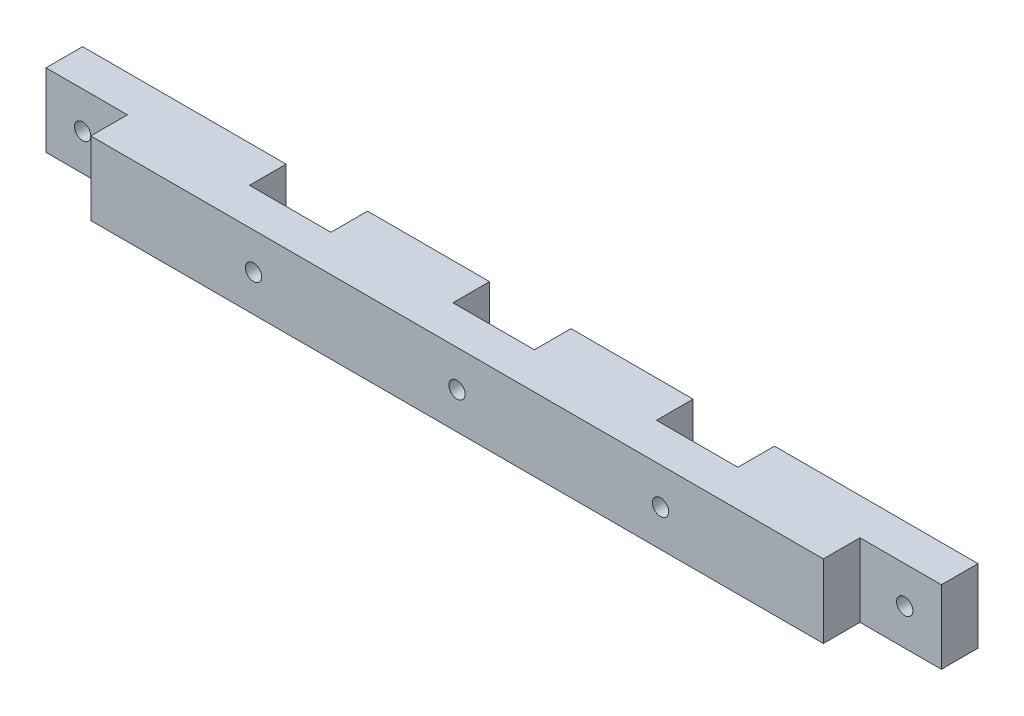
SolidWorks part; units mm, degrees
ref_plane "Face" through (0, 0, 0) normal (0, 0, 1) x (1, 0, 0)
ref_plane "Dessus" through (0, 0, 0) normal (0, 1, 0) x (1, 0, 0)
ref_plane "Droite" through (0, 0, 0) normal (1, 0, 0) x (0, 0, -1)
sketch "Esquisse1" plane through (0, 0, 0) normal (0, 0, 1) x (1, 0, 0)
  line L1 (-67.2717, -109.6176) -> (42.7283, -109.6176)
  line L2 (-67.2717, -109.6176) -> (-67.2717, -100.6176)
  line L3 (-67.2717, -100.6176) -> (42.7283, -100.6176)
  line L4 (42.7283, -109.6176) -> (42.7283, -100.6176)
  dimension "D1" = 110
  dimension "D2" = 9
extrude "Extrusion1" add sketch "Esquisse1" along normal blind 9
sketch "Esquisse2" plane through (0, 0, 9) normal (0, 0, 1) x (1, 0, 0)
  line L0 (42.7283, -100.6176) -> (-67.2717, -100.6176) construction
  line L1 (-67.2717, -109.6176) -> (-57.2717, -109.6176)
  line L2 (-67.2717, -109.6176) -> (-67.2717, -100.6176)
  line L3 (-67.2717, -100.6176) -> (-57.2717, -100.6176)
  line L4 (-57.2717, -109.6176) -> (-57.2717, -100.6176)
  line L6 (42.7283, -109.6176) -> (32.7283, -109.6176)
  line L7 (42.7283, -109.6176) -> (42.7283, -100.6176)
  line L8 (42.7283, -100.6176) -> (32.7283, -100.6176)
  line L9 (32.7283, -109.6176) -> (32.7283, -100.6176)
  dimension "D1" = 10
  dimension "D2" = 10
extrude "Enlèv. mat.-Extru.1" cut sketch "Esquisse2" against normal blind 4.5
sketch "Esquisse4" plane through (0, 0, 4.5) normal (0, 0, 1) x (1, 0, 0)
  line L0 (42.7283, -109.6176) -> (42.7283, -100.6176) construction
  line L1 (32.7283, -109.6176) -> (42.7283, -109.6176) construction
  circle A0 centre (38.2284, -105.1454) radius 1
  point P2 (42.7283, -105.1176)
  point P5 (37.7283, -109.6176)
  dimension "D3" = 2
  dimension "D1" = 4.5
  dimension "D2" = 4.5
extrude "Enlèv. mat.-Extru.2" cut sketch "Esquisse4" against normal blind 4.5
sketch "Esquisse5" plane through (0, 0, 4.5) normal (0, 0, 1) x (1, 0, 0)
  line L0 (-67.2717, -109.6176) -> (-57.2717, -109.6176) construction
  line L1 (-67.2717, -100.6176) -> (-67.2717, -109.6176) construction
  circle A0 centre (-62.7717, -105.1176) radius 1
  dimension "D1" = 2
  dimension "D2" = 4.5
  dimension "D3" = 4.5
extrude "Enlèv. mat.-Extru.3" cut sketch "Esquisse5" against normal blind 4.5
sketch "Esquisse6" plane through (0, 0, 0) normal (0, 0, -1) x (-1, 0, 0)
  line L0 (-42.7283, -100.6176) -> (67.2717, -100.6176) construction
  line L2 (-17.7283, -109.6176) -> (-7.7283, -109.6176)
  line L3 (-17.7283, -109.6176) -> (-17.7283, -100.6176)
  line L4 (-17.7283, -100.6176) -> (-7.7283, -100.6176)
  line L5 (67.2717, -109.6176) -> (-42.7283, -109.6176) construction
  line L6 (-7.7283, -109.6176) -> (-7.7283, -100.6176)
  line L11 (7.2717, -100.6176) -> (17.2717, -100.6176)
  line L12 (7.2717, -100.6176) -> (7.2717, -109.6176)
  line L13 (7.2717, -109.6176) -> (17.2717, -109.6176)
  line L14 (17.2717, -100.6176) -> (17.2717, -109.6176)
  line L15 (32.2717, -100.6176) -> (42.2717, -100.6176)
  line L16 (32.2717, -100.6176) -> (32.2717, -109.6176)
  line L17 (32.2717, -109.6176) -> (42.2717, -109.6176)
  line L18 (42.2717, -100.6176) -> (42.2717, -109.6176)
  dimension "D1" = 10
  dimension "D2" = 15
  dimension "D3" = 10
  dimension "D4" = 10
  dimension "D5" = 25
  dimension "D6" = 25
extrude "Enlèv. mat.-Extru.4" cut sketch "Esquisse6" against normal blind 4.5
sketch "Esquisse7" plane through (0, 0, 4.5) normal (0, 0, -1) x (-1, 0, 0)
  line L0 (-7.7283, -109.6176) -> (-7.7283, -100.6176) construction
  line L1 (17.2717, -109.6176) -> (17.2717, -100.6176) construction
  line L2 (42.2717, -109.6176) -> (42.2717, -100.6176) construction
  line L3 (-17.7283, -109.6176) -> (-7.7283, -109.6176) construction
  line L4 (7.2717, -109.6176) -> (17.2717, -109.6176) construction
  line L5 (32.2717, -109.6176) -> (42.2717, -109.6176) construction
  circle A0 centre (-12.7283, -105.1176) radius 1
  circle A1 centre (12.2717, -105.1176) radius 1
  circle A2 centre (37.2717, -105.1176) radius 1
  dimension "D7" = 2
  dimension "D8" = 2
  dimension "D9" = 2
  dimension "D1" = 5
  dimension "D2" = 5
  dimension "D3" = 5
  dimension "D4" = 4.5
  dimension "D5" = 4.5
  dimension "D6" = 4.5
extrude "Enlèv. mat.-Extru.5" cut sketch "Esquisse7" against normal blind 4.5
